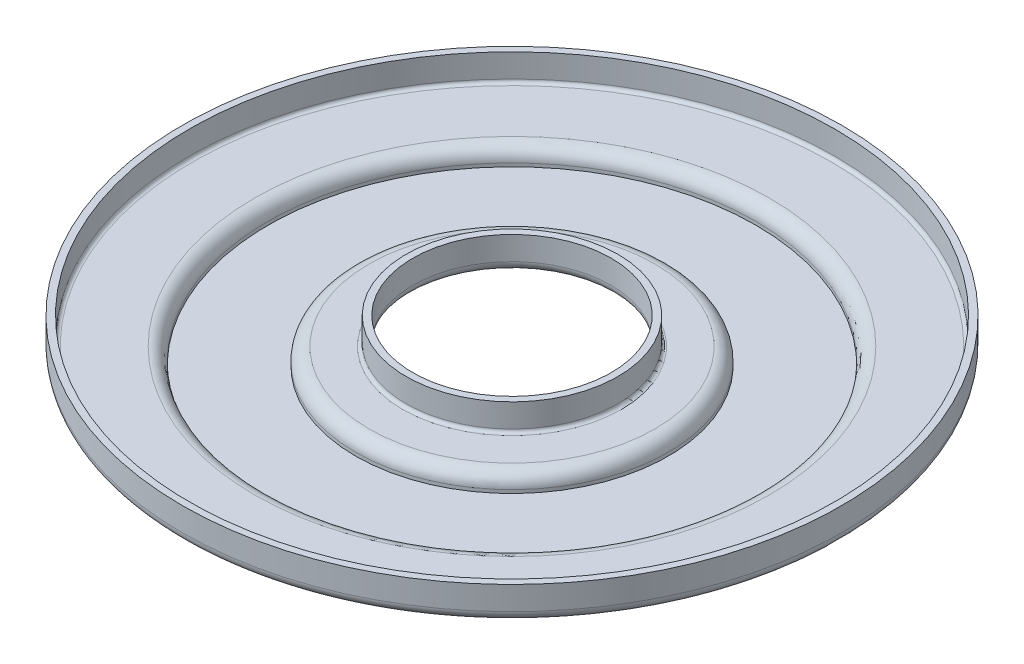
SolidWorks part; units mm, degrees
ref_plane "Face" through (0, 0, 0) normal (0, 0, 1) x (1, 0, 0)
ref_plane "Dessus" through (0, 0, 0) normal (0, 1, 0) x (1, 0, 0)
ref_plane "Droite" through (0, 0, 0) normal (1, 0, 0) x (0, 0, -1)
sketch "Esquisse1" plane through (0, 0, 0) normal (0, 0, 1) x (1, 0, 0)
  line L0 (0, 0) -> (0, 81.1344) construction
  line L1 (29.5, 15) -> (29.5, 8)
  line L2 (46.5, 0) -> (72.5, 0)
  line L3 (98, 8) -> (98, 15)
  line L4 (95, 5) -> (76.5, 5)
  line L5 (0, 15) -> (98, 15) construction
  line L6 (98, 0) -> (0, 0) construction
  line L7 (74.5, 3) -> (74.5, 2)
  line L8 (44.5, 2) -> (44.5, 3)
  line L9 (42.5, 5) -> (32.5, 5)
  line L10 (74.5, 5) -> (44.5, 5) construction
  arc A0 (95, 5) -> (98, 8) centre (95, 8) ccw
  arc A1 (32.5, 5) -> (29.5, 8) centre (32.5, 8) cw
  arc A2 (44.5, 2) -> (46.5, 0) centre (46.5, 2) ccw
  arc A3 (74.5, 2) -> (72.5, 0) centre (72.5, 2) cw
  arc A4 (76.5, 5) -> (74.5, 3) centre (76.5, 3) ccw
  arc A5 (44.5, 3) -> (42.5, 5) centre (42.5, 3) ccw
  point P16 (32.684, 15)
  point P20 (44.5, 0)
  point P23 (74.5, 0)
  dimension "D5" = 5
  dimension "D4" = 15
  dimension "D7" = 3
  dimension "D6" = 30
  dimension "D8" = 2
  dimension "D1" = 59
  dimension "D2" = 98
  dimension "D3" = 15
revolve "Révol.-Mince1" add sketch "Esquisse1" angle 360 about L0
